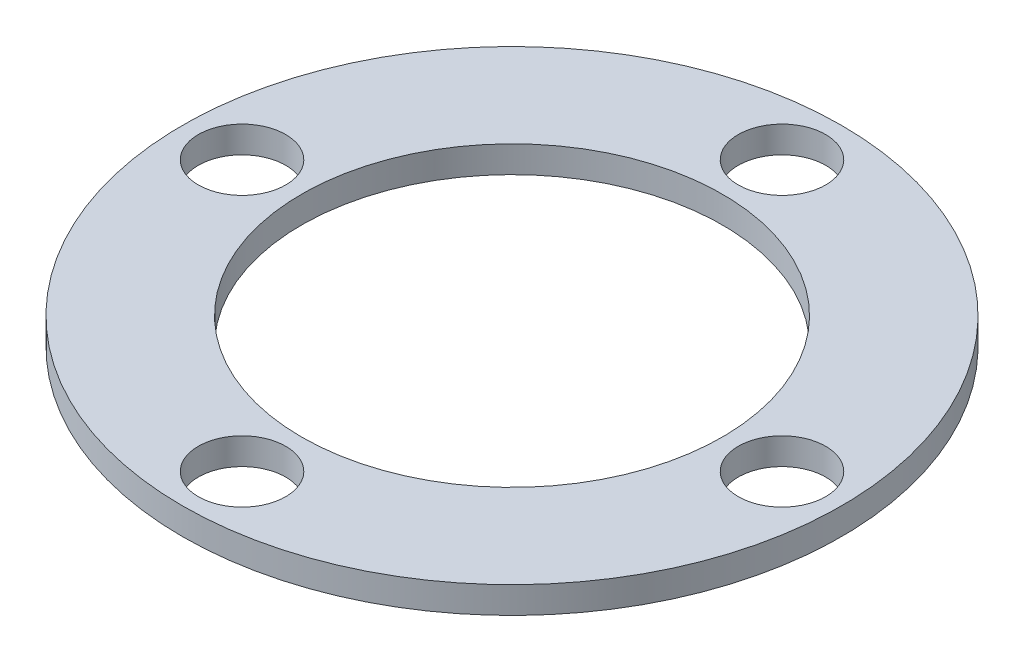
SolidWorks part; units mm, degrees
ref_plane "Front Plane" through (0, 0, 0) normal (0, 0, 1) x (1, 0, 0)
ref_plane "Top Plane" through (0, 0, 0) normal (0, 1, 0) x (1, 0, 0)
ref_plane "Right Plane" through (0, 0, 0) normal (1, 0, 0) x (0, 0, -1)
sketch "Sketch1" plane through (0, 0, 0) normal (0, 1, 0) x (1, 0, 0)
  circle A0 centre (0, 0) radius 32.9438
  circle A1 centre (0, 0) radius 21.0312
  dimension "D1" = 65.8876
  dimension "D2" = 42.0624
extrude "Extrude1" add sketch "Sketch1" along normal blind 2.667
hole_wizard "Hole1" positions "Sketch3" profile "Sketch2" legacy
sketch "Sketch3" plane through (0, 2.667, 0) normal (0, 1, 0) x (-1, 0, 0)
  line L0 (0, 0) -> (0, -34.4487) construction
  circle A0 centre (0, 0) radius 26.9875 construction
  point P0 (0, -26.9875)
  dimension "D1" = 53.975
sketch "Sketch2" plane through (0, 2.667, -26.9875) normal (1, 0, 0) x (0, 0, 1)
  line L0 (0, 0) -> (0, 2.667)
  line L1 (0, 2.667) -> (4.3688, 2.667)
  line L2 (4.3688, 2.667) -> (4.3688, 0)
  line L3 (4.3688, 0) -> (0, 0)
  line L4 (0, 110) -> (0, -10) construction
  dimension "Diameter" = 8.7376
  dimension "Depth" = 2.667
pattern_circular "CirPattern1" count 4 over 360 about axis through (0, 0, 0) along (0, 1, 0) of "Hole1"
